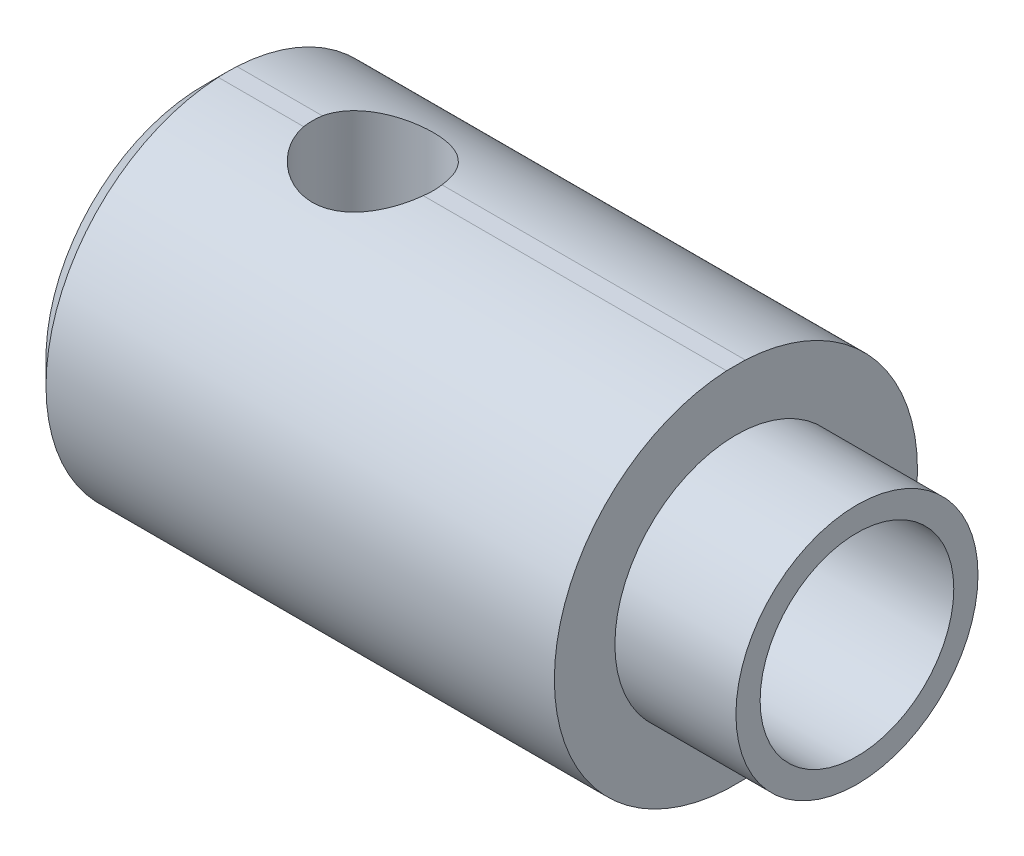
SolidWorks part; units mm, degrees
ref_plane "Front" through (0, 0, 0) normal (0, 0, 1) x (1, 0, 0)
ref_plane "Top" through (0, 0, 0) normal (0, 1, 0) x (1, 0, 0)
ref_plane "Right" through (0, 0, 0) normal (1, 0, 0) x (0, 0, -1)
sketch "Sketch1" plane through (0, 0, 0) normal (0, 1, 0) x (1, 0, 0)
  line L1 (20, 4) -> (20, 5)
  line L2 (20, 5) -> (15, 5)
  line L3 (15, 5) -> (15, 7.5)
  line L4 (15, 7.5) -> (0, 7.5)
  line L5 (-6, 7.5) -> (-7, 6.5)
  line L6 (-7, 6.5) -> (-7, 0)
  line L7 (0, 7.5) -> (-6, 7.5)
  line L8 (-2.3094, 0) -> (-7, 0)
  line L9 (0, 4) -> (20, 4)
  line L11 (0, 4) -> (-2.3094, 0)
  point P3 (-7, 7.5)
revolve "Revolve1" add sketch "Sketch1" angle 360 about L8
sketch "Sketch2" plane through (0, 0, 0) normal (0, 1, 0) x (1, 0, 0)
  circle A0 centre (0, 0) radius 2.5
extrude "Cut-Extrude1" cut sketch "Sketch2" against normal mid plane 20
sketch "Sketch3" plane through (15, 0, 0) normal (1, 0, 0) x (0, 0, -1)
  line L0 (0.3872, 7.49) -> (-0.3872, 7.49)
  line L3 (0.3872, -7.49) -> (-0.3872, -7.49)
  arc A0 (-0.3872, -7.49) -> (0.3872, -7.49) centre (0, 0) ccw
  arc A1 (0.3872, 7.49) -> (-0.3872, 7.49) centre (0, 0) ccw
extrude "Cut-Extrude2" cut sketch "Sketch3" against normal through all
